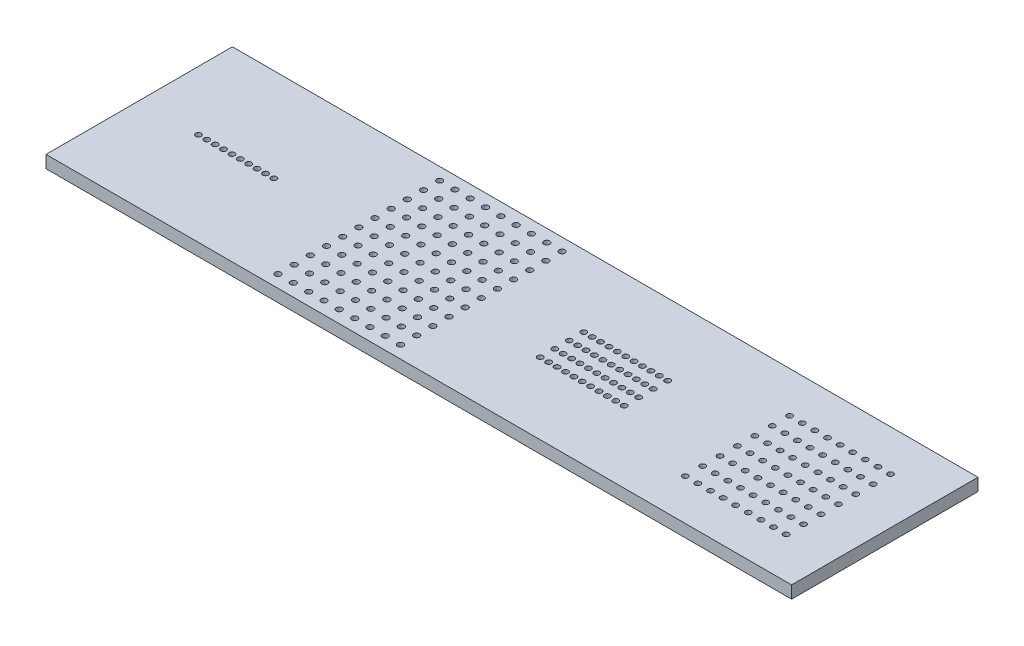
SolidWorks part; units mm, degrees
ref_plane "Plan de face" through (0, 0, 0) normal (0, 0, 1) x (1, 0, 0)
ref_plane "Plan de dessus" through (0, 0, 0) normal (0, 1, 0) x (1, 0, 0)
ref_plane "Plan de droite" through (0, 0, 0) normal (1, 0, 0) x (0, 0, -1)
sketch "Esquisse2" plane through (0, 0, 0) normal (0, 1, 0) x (1, 0, 0)
  line L1 (-60, -15) -> (60, -15)
  line L2 (-60, -15) -> (-60, 15)
  line L3 (-60, 15) -> (60, 15)
  line L4 (60, -15) -> (60, 15)
  line L5 (-60, -15) -> (60, 15) construction
  line L6 (-60, 15) -> (60, -15) construction
  point P0 (0, 0)
  dimension "D1" = 30
  dimension "D2" = 120
extrude "Boss.-Extru.1" add sketch "Esquisse2" along normal blind 2 contours L3 L4 L1 L2
sketch "Cavités" plane through (0, 0, 0) normal (0, 1, 0) x (1, 0, 0)
  line L0 (-60, -15) -> (60, -15) construction
  line L1 (-58.4, 15) -> (-30.4, 15) construction
  line L2 (-58.4, 15) -> (-58.4, -15) construction
  line L3 (-58.4, -15) -> (-30.4, -15) construction
  line L4 (-30.4, 15) -> (-30.4, -15) construction
  line L5 (-60, 15) -> (60, 15) construction
  line L6 (-28.8, 15) -> (-0.8, 15) construction
  line L7 (-28.8, 15) -> (-28.8, -15) construction
  line L8 (-28.8, -15) -> (-0.8, -15) construction
  line L9 (-0.8, 15) -> (-0.8, -15) construction
  line L10 (-30.4, 15) -> (-28.8, 15) construction
  line L11 (0.8, 15) -> (28.8, 15) construction
  line L12 (0.8, 15) -> (0.8, -15) construction
  line L13 (0.8, -15) -> (28.8, -15) construction
  line L14 (28.8, 15) -> (28.8, -15) construction
  line L15 (30.4, 15) -> (58.4, 15) construction
  line L16 (30.4, 15) -> (30.4, -15) construction
  line L17 (30.4, -15) -> (58.4, -15) construction
  line L18 (58.4, 15) -> (58.4, -15) construction
  line L19 (-0.8, 15) -> (0.8, 15) construction
  line L20 (28.8, 15) -> (30.4, 15) construction
  line L21 (-60, 15) -> (-58.4, 15) construction
  line L22 (58.4, 15) -> (60, 15) construction
  dimension "D1" = 28
  dimension "D2" = 1.6
sketch "Esquisse7" plane through (0, 2, 0) normal (0, 1, 0) x (1, 0, 0)
  line L0 (-58.4, 0) -> (-50.475, 0) construction
  line L5 (-58.4, 15) -> (-58.4, -15) construction
  line L6 (-38.325, 0) -> (-30.4, 0) construction
  line L7 (-30.4, 15) -> (-30.4, -15) construction
  line L8 (-50.475, 0) -> (-38.325, 0) construction
  dimension "D1" = 12.15
sketch "Esquisse8" plane through (0, 2, 0) normal (0, 1, 0) x (1, 0, 0)
  circle A0 centre (-50.475, 0) radius 0.45
  dimension "D1" = 0.9
extrude "Enlèv. mat.-Extru.3" cut sketch "Esquisse8" against normal up to next
pattern_linear "Répétition linéaire4" count 10 spacing 1.35 along (1, 0, 0) of "Enlèv. mat.-Extru.3"
sketch "Esquisse9" plane through (0, 2, 0) normal (0, 1, 0) x (1, 0, 0)
  line L0 (-28.8, 0) -> (-24.656, 0) construction
  line L1 (-24.656, 13) -> (-4.944, 13) construction
  line L2 (-24.656, 13) -> (-24.656, -13) construction
  line L3 (-24.656, -13) -> (-4.944, -13) construction
  line L4 (-4.944, 13) -> (-4.944, -13) construction
  line L5 (-28.8, 15) -> (-28.8, -15) construction
  line L6 (-4.944, 0) -> (-0.8, 0) construction
  line L7 (-0.8, 15) -> (-0.8, -15) construction
  dimension "D1" = 19.712
  dimension "D2" = 26
sketch "Esquisse10" plane through (0, 2, 0) normal (0, 1, 0) x (1, 0, 0)
  circle A0 centre (-24.656, 13) radius 0.475
  dimension "D1" = 0.95
extrude "Enlèv. mat.-Extru.4" cut sketch "Esquisse10" against normal up to next
pattern_linear "Répétition linéaire5" count 9 spacing 2.464 along (1, 0, 0) count 11 spacing 2.6 along (0, 0, 1) of "Enlèv. mat.-Extru.4"
sketch "Esquisse11" plane through (0, 2, 0) normal (0, 1, 0) x (1, 0, 0)
  line L0 (0.8, 0) -> (8.05, 0) construction
  line L1 (8.05, 3.4995) -> (21.55, 3.4995) construction
  line L2 (8.05, 3.4995) -> (8.05, -3.4995) construction
  line L3 (8.05, -3.4995) -> (21.55, -3.4995) construction
  line L4 (21.55, 3.4995) -> (21.55, -3.4995) construction
  line L5 (0.8, 15) -> (0.8, -15) construction
  line L6 (21.55, 0) -> (28.8, 0) construction
  line L7 (28.8, 15) -> (28.8, -15) construction
  dimension "D1" = 13.5
  dimension "D2" = 6.999
sketch "Esquisse12" plane through (0, 2, 0) normal (0, 1, 0) x (1, 0, 0)
  circle A0 centre (8.05, 3.4995) radius 0.45
  dimension "D1" = 0.9
extrude "Enlèv. mat.-Extru.5" cut sketch "Esquisse12" against normal up to next
pattern_linear "Répétition linéaire6" count 11 spacing 1.35 along (1, 0, 0) count 4 spacing 2.333 along (0, 0, 1) of "Enlèv. mat.-Extru.5"
sketch "Esquisse13" plane through (0, 2, 0) normal (0, 1, 0) x (1, 0, 0)
  line L0 (30.4, 0) -> (36.28, 0) construction
  line L1 (36.28, 8.4) -> (52.52, 8.4) construction
  line L2 (36.28, 8.4) -> (36.28, -8.4) construction
  line L3 (36.28, -8.4) -> (52.52, -8.4) construction
  line L4 (52.52, 8.4) -> (52.52, -8.4) construction
  line L5 (30.4, 15) -> (30.4, -15) construction
  line L6 (52.52, 0) -> (58.4, 0) construction
  line L7 (58.4, 15) -> (58.4, -15) construction
  dimension "D1" = 16.8
  dimension "D2" = 16.24
sketch "Esquisse14" plane through (0, 2, 0) normal (0, 1, 0) x (1, 0, 0)
  circle A0 centre (36.28, 8.4) radius 0.45
  dimension "D1" = 0.9
extrude "Enlèv. mat.-Extru.6" cut sketch "Esquisse14" against normal up to next
pattern_linear "Répétition linéaire7" count 9 spacing 2.03 along (1, 0, 0) count 7 spacing 2.8 along (0, 0, 1) of "Enlèv. mat.-Extru.6"
